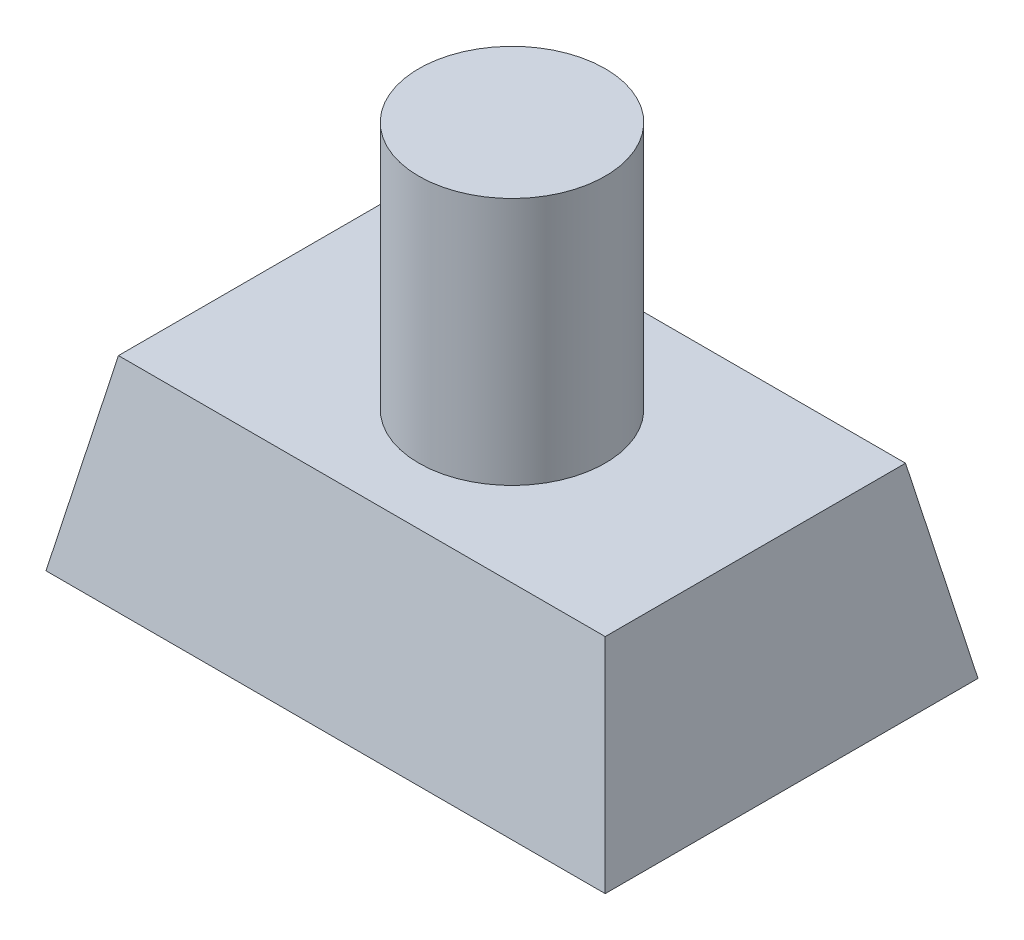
SolidWorks part; units mm, degrees
ref_plane "Front Plane" through (0, 0, 0) normal (0, 0, 1) x (1, 0, 0)
ref_plane "Top Plane" through (0, 0, 0) normal (0, 1, 0) x (1, 0, 0)
ref_plane "Right Plane" through (0, 0, 0) normal (1, 0, 0) x (0, 0, -1)
sketch "Sketch1" plane through (0, 0, 0) normal (0, 1, 0) x (1, 0, 0)
  line L1 (0, 0) -> (90, 0)
  line L2 (0, 0) -> (0, 60)
  line L3 (0, 60) -> (90, 60)
  line L4 (90, 0) -> (90, 60)
  dimension "D1" = 90
  dimension "D2" = 60
extrude "Extrude1" add sketch "Sketch1" along normal blind 30 draft 11
sketch "Sketch2" plane through (0, 30, 0) normal (0, 1, 0) x (-1, 0, 0)
  line L0 (-45, -54.1686) -> (-45, -5.8314) construction
  line L1 (-84.1686, -54.1686) -> (-5.8314, -54.1686) construction
  line L2 (-5.8314, -5.8314) -> (-84.1686, -5.8314) construction
  circle A0 centre (-45, -30) radius 15
  dimension "D1" = 30
extrude "Extrude2" add sketch "Sketch2" along normal blind 40
equation "\"D2@Sketch1\" = \"D1@Sketch2\" * 2"
equation "\"D1@Sketch1\" = \"D2@Sketch1\" * 1.5"
